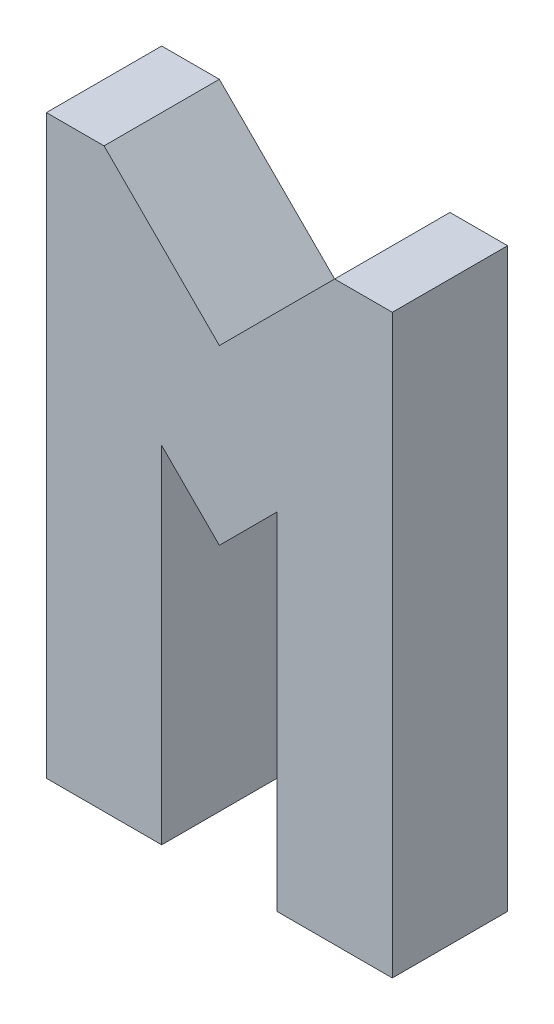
SolidWorks part; units mm, degrees
ref_plane "Plan de face" through (0, 0, 0) normal (0, 0, 1) x (1, 0, 0)
ref_plane "Plan de dessus" through (0, 0, 0) normal (0, 1, 0) x (1, 0, 0)
ref_plane "Plan de droite" through (0, 0, 0) normal (1, 0, 0) x (0, 0, -1)
sketch "Esquisse1" plane through (0, 0, 0) normal (0, 0, 1) x (1, 0, 0)
  line L0 (20, 30) -> (15, 25)
  line L1 (0, 0) -> (10, 0)
  line L2 (0, 0) -> (0, 50)
  line L3 (0, 50) -> (5, 50)
  line L4 (30, 0) -> (30, 50)
  line L5 (20, 0) -> (30, 0)
  line L6 (10, 0) -> (10, 30)
  line L7 (10, 30) -> (15, 25)
  line L9 (25, 50) -> (30, 50)
  line L10 (20, 0) -> (20, 30)
  line L12 (5, 50) -> (15, 40)
  line L13 (25, 50) -> (15, 40)
  dimension "D1" = 50
  dimension "D2" = 30
  dimension "D3" = 10
  dimension "D7" = 10
  dimension "D9" = 30
  dimension "D11" = 30
extrude "Boss.-Extru.1" add sketch "Esquisse1" along normal blind 10
